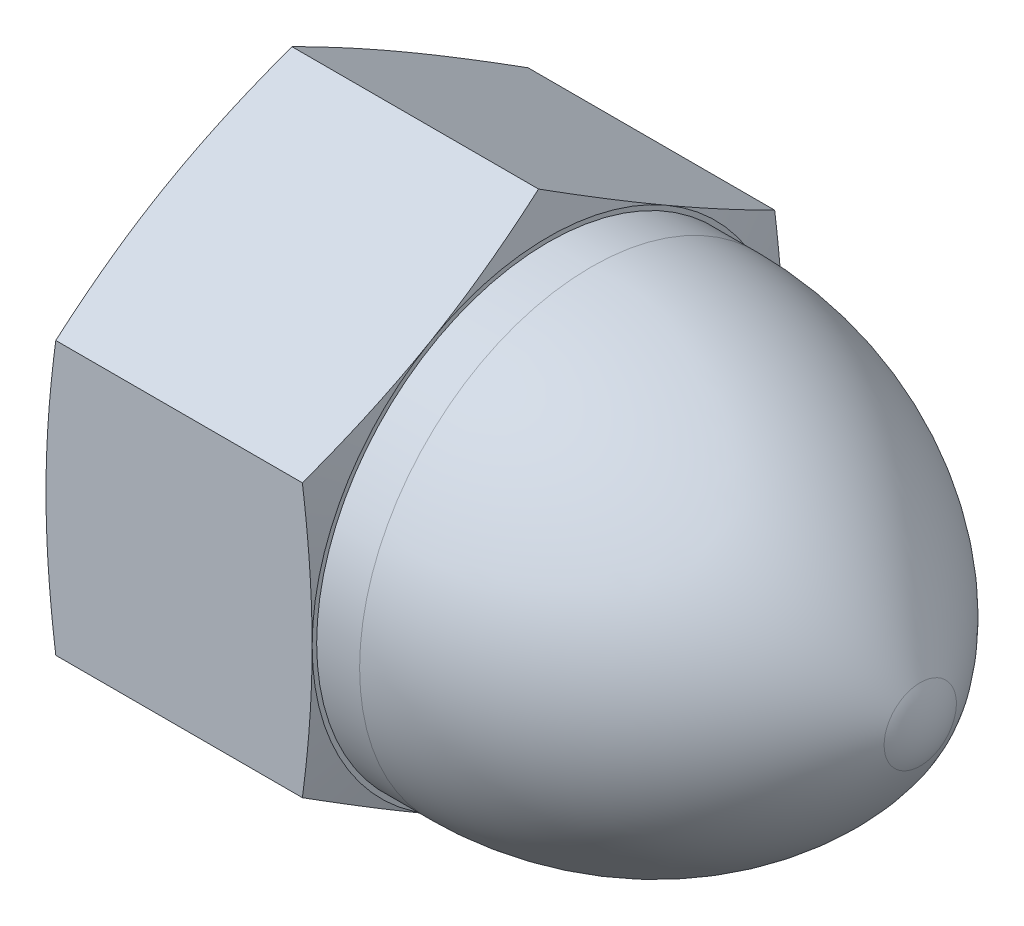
SolidWorks part; units mm, degrees
ref_plane "Plane1" through (0, 0, 0) normal (0, 0, 1) x (1, 0, 0)
ref_plane "Plane2" through (0, 0, 0) normal (0, 1, 0) x (1, 0, 0)
ref_plane "Plane3" through (0, 0, 0) normal (1, 0, 0) x (0, 0, -1)
sketch "BaseNutSke" plane through (0, 0, 0) normal (1, 0, 0) x (0, 0, -1)
  line L6 (18.2562, 10.5403) -> (18.2562, -10.5403)
  line L7 (-18.2562, 10.5403) -> (-18.2563, -10.5403)
  line L8 (18.2562, 10.5403) -> (0, 21.0805)
  line L9 (0, 21.0805) -> (-18.2562, 10.5403)
  line L10 (-18.2563, -10.5403) -> (0, -21.0805)
  line L11 (0, -21.0805) -> (18.2562, -10.5403)
  dimension "D4" = 60
  dimension "D1" = 120
  dimension "D2" = 18.2562
  dimension "D3" = 18.2562
  dimension "Width_flats" = 36.5125
extrude "BaseNut" add sketch "BaseNutSke" along normal blind 20.574
sketch "Sketch3" plane through (0, 0, 0) normal (0, 0, 1) x (1, 0, 0)
  line L0 (0, 0) -> (63.5, 0) construction
  line L1 (0, 10.5403) -> (0, -10.5403) construction
  line L2 (50.038, 0) -> (0, 0)
  line L3 (0, 17.907) -> (23.8939, 17.907)
  line L4 (0, -17.907) -> (22.225, -17.907) construction
  line L5 (0, 17.907) -> (0, 0)
  arc A0 (50.038, 0) -> (49.3273, 2.7926) centre (44.196, 0) ccw
  arc A1 (49.3273, 2.7926) -> (23.8939, 17.907) centre (23.8939, -11.049) ccw
  dimension "Nose_radius" = 5.842
  dimension "Body_radius" = 28.956
  dimension "Overall_ht" = 50.038
  dimension "Body_dia" = 35.814
revolve "Crown" add sketch "Sketch3" angle 360 about L0
sketch "Sketch4" plane through (0, 0, 0) normal (0, 0, 1) x (1, 0, 0)
  line L0 (0, 18.2562) -> (1.9499, 25.5333)
  line L1 (20.574, 18.2562) -> (18.6245, 25.5333)
  line L2 (1.9499, 25.5333) -> (18.6245, 25.5333)
  line L3 (20.574, 18.2562) -> (33.274, 18.2562)
  line L4 (33.274, 18.2562) -> (33.274, 43.6562)
  line L5 (33.274, 43.6562) -> (-12.7, 43.6562)
  line L6 (0, 18.2562) -> (-12.7, 18.2562)
  line L7 (-12.7, 18.2562) -> (-12.7, 43.6562)
  line L8 (20.574, 21.0805) -> (20.574, 10.5403) construction
  line L9 (0, 21.0805) -> (0, 10.5403) construction
  line L10 (0, 0) -> (57.15, 0) construction
  point P17 (20.574, 18.2562)
  dimension "D1" = 14.997
  dimension "D2" = 15
  dimension "D3" = 12.7
  dimension "D4" = 12.7
  dimension "D5" = 18.1229
  dimension "D6" = 25.4
  dimension "D7" = 18.2562
revolve "DoubleChamfer" cut sketch "Sketch4" angle 360 about L10
sketch "Sketch5" plane through (0, 0, 0) normal (0, 0, 1) x (1, 0, 0)
  line L0 (0, 0) -> (44.45, 0) construction
  line L1 (0, 11.1125) -> (35.052, 11.1125)
  line L2 (0, 15.8104) -> (0, 0) construction
  line L3 (35.052, 11.1125) -> (41.7291, 0)
  line L4 (0, 0) -> (63.5, 0) construction
  line L5 (41.7291, 0) -> (0, 0)
  line L6 (0, 0) -> (0, 11.1125)
  line L7 (35.052, -11.1125) -> (41.7291, 0) construction
  line L8 (0, -11.1125) -> (35.052, -11.1125) construction
  dimension "TPA" = 118
  dimension "Thread_min" = 22.225
  dimension "Drill_depth" = 35.052
revolve "TapDrill" cut sketch "Sketch5"
revolve "EndChamfer" cut sketch "EndChamferSketch" angle 360 about L4
sketch "EndChamferSketch" plane through (0, 0, 0) normal (0, 0, 1) x (1, 0, 0)
  line L0 (-0.0254, 12.7) -> (0.0254, 12.7)
  line L1 (0.0254, 12.7) -> (1.2481, 10.9537)
  line L2 (1.2481, 10.9537) -> (-0.0254, 10.9537)
  line L3 (-0.0254, 10.9537) -> (-0.0254, 12.7)
  line L4 (-3.175, 0) -> (-15.875, 0) construction
  dimension "D1" = 0.0508
  dimension "D2" = 35
  dimension "D3" = 0.0254
  dimension "ChamferDepth" = 1.7463
  dimension "ThreadMajor" = 12.7
sketch "ThdSchSke" plane through (0, 0, 0) normal (0, 1, 0) x (1, 0, 0)
  line L0 (0.0381, 12.7) -> (-1.0735, 11.1125)
  line L1 (-1.0735, 11.1125) -> (-1.0735, 4.2333)
  line L2 (-1.0735, 4.2333) -> (1.1497, 4.2333)
  line L3 (1.1497, 4.2333) -> (1.1497, 11.1125)
  line L4 (1.1497, 11.1125) -> (0.0381, 12.7)
  line L5 (-25.4, 0) -> (1.1497, 0) construction
  line L9 (3.2131, 3.175) -> (3.2131, -3.175) construction
  dimension "D1" = 0.0381
  dimension "VeeAngle" = 70
  dimension "SideAngle" = 55
  dimension "Thread_major" = 25.4
  dimension "Tap_drill" = 22.225
  dimension "OverCut" = 8.4667
  dimension "Advance" = 3.175
revolve "ThreadSchematic" [suppressed] cut sketch "ThdSchSke" angle 360 about L5
pattern_linear "ThdSchPat" [suppressed]
equation "\"D2@BaseNutSke\" = \"Width_flats@BaseNutSke\" / 2"
equation "\"D3@BaseNutSke\" = \"Width_flats@BaseNutSke\" / 2"
equation "\"D7@Sketch4\" = \"Width_flats@BaseNutSke\" / 2"
equation "\"Thread_major@ThdSchSke\" = \"Thread_nominal@ThreadCosmetic\""
equation "\"Tap_drill@ThdSchSke\" = \"Thread_min@Sketch5\""
equation "\"OverCut@ThdSchSke\" =  \"Thread_nominal@ThreadCosmetic\" / 3"
equation "\"Num_threads@ThdSchPat\" = int(  ( \"Hex_ht@BaseNut\" - 0.002 ) / \"Advance@ThdSchSke\" + 0.999 )  + 1"
equation "\"Advance@ThdSchPat\" = ( \"Hex_ht@BaseNut\" - 0.002 ) /  (\"Num_threads@ThdSchPat\" - 1) 'relax it"
equation "' \"Num_threads@ThdSchPat\" = \"Num_threads@ThdSchPat\" - sgn( \"Num_threads@ThdSchPat\" - 1) '---chamfered tips only---"
equation "\"ThreadMajor@EndChamferSketch\" = \"Thread_nominal@ThreadCosmetic\" * 0.5"
equation "\"ChamferDepth@EndChamferSketch\" = (\"Thread_nominal@ThreadCosmetic\" - \"Thread_min@Sketch5\") * 0.55"
